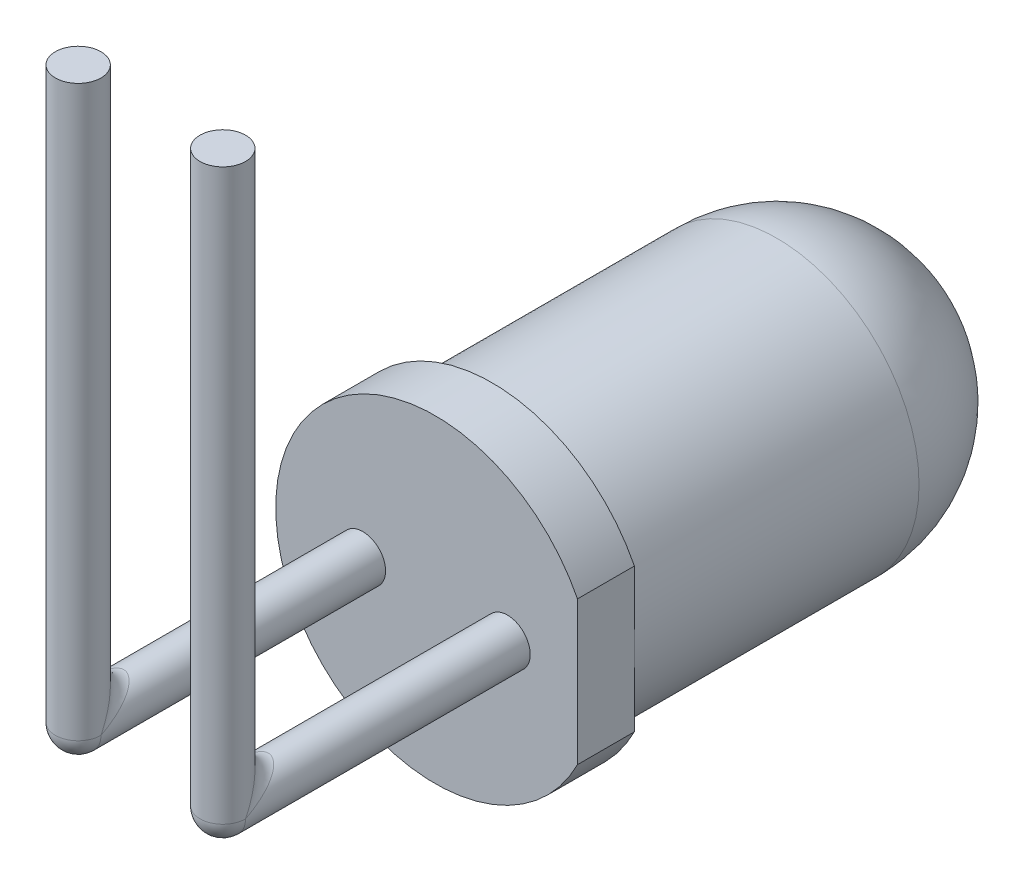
SolidWorks part; units mm, degrees
ref_plane "Face" through (0, 0, 0) normal (0, 0, 1) x (1, 0, 0)
ref_plane "Dessus" through (0, 0, 0) normal (0, 1, 0) x (1, 0, 0)
ref_plane "Droite" through (0, 0, 0) normal (1, 0, 0) x (0, 0, -1)
sketch "Esquisse1" plane through (0, 0, 0) normal (0, 0, 1) x (1, 0, 0)
  circle A0 centre (0, 0) radius 2.5
extrude "Base-Extrusion" add sketch "Esquisse1" along normal blind 8.5
sketch "Esquisse2" plane through (0, 0, 8.5) normal (0, 0, 1) x (1, 0, 0)
  line L0 (2.5, -2.4917) -> (2.5, 2.5621) construction
  line L1 (2.5, 1.261) -> (2.5, -1.261)
  arc A0 (2.5, 1.261) -> (2.5, -1.261) centre (0, 0) ccw
extrude "Boss.-Extru.1" add sketch "Esquisse2" against normal blind 1
fillet "Congé1" radius 2.5 1 edges at (2.5, 0, 0)
sketch "Esquisse3" plane through (0, 0, 8.5) normal (0, 0, 1) x (1, 0, 0)
  line L0 (0, 1.4329) -> (0, -0.9388) construction
  circle A0 centre (1.27, 0) radius 0.4
  circle A1 centre (-1.27, 0) radius 0.4
ref_plane "Plan1" through (0, 0, 0) normal (1, 0, 0) x (0, 0, -1)
sketch "Esquisse4" plane through (0, 0, 0) normal (1, 0, 0) x (0, 0, -1)
  line L0 (-8.5, 0) -> (-13.5, 0)
  line L1 (-8.5, 0.4) -> (-8.5, -0.4) construction
  line L2 (-13.5, 0) -> (-13.5, 10)
sweep "Balayage1" add profiles "Esquisse3" path "Esquisse4"
fillet "Congé2" radius 0.4 2 edges at (1.27, 0.4, 13.1) (-1.27, 0.4, 13.1)
